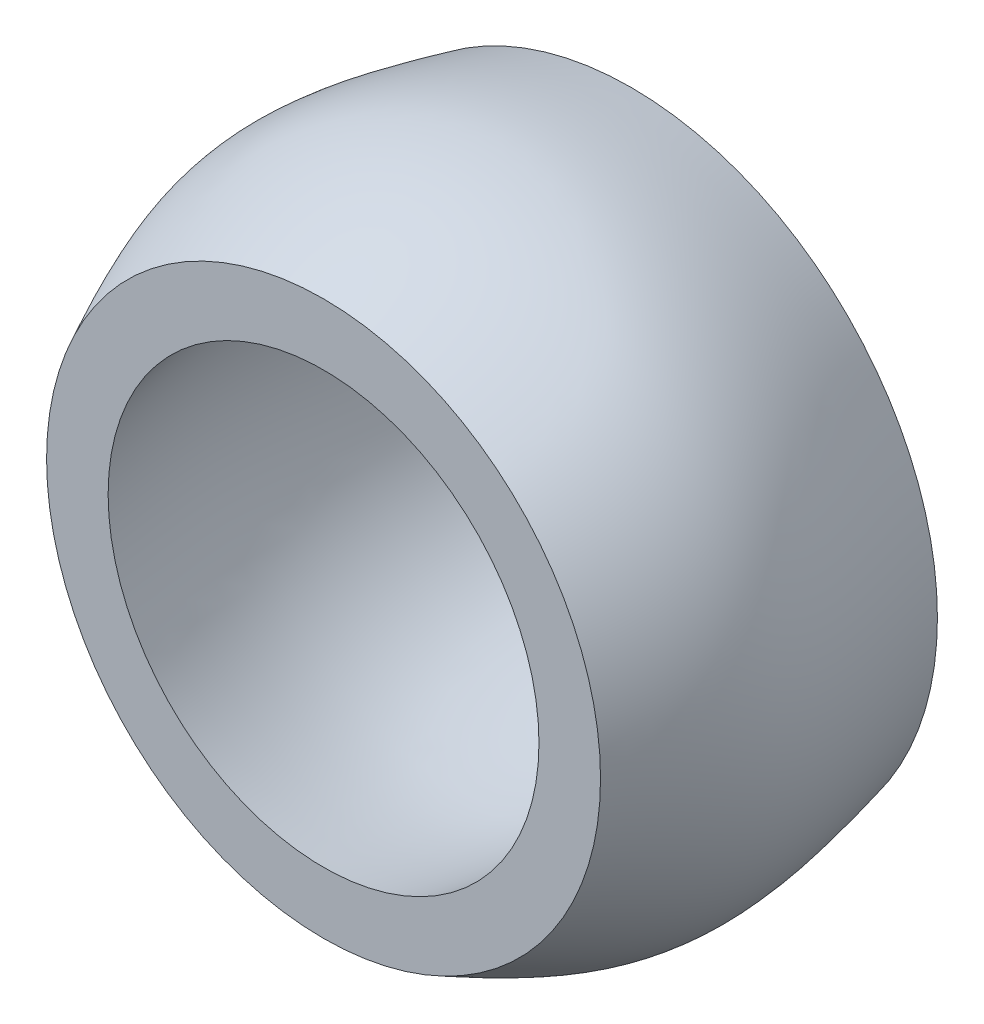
SolidWorks part; units mm, degrees
ref_plane "Face" through (0, 0, 0) normal (0, 0, 1) x (1, 0, 0)
ref_plane "Dessus" through (0, 0, 0) normal (0, 1, 0) x (1, 0, 0)
ref_plane "Droite" through (0, 0, 0) normal (1, 0, 0) x (0, 0, -1)
sketch "Esquisse2" plane through (0, 0, 0) normal (0, 1, 0) x (1, 0, 0)
  line L1 (14, -20) -> (-14, -20) construction
  line L2 (0, 0) -> (0, -23.8736) construction
  line L3 (14, 0) -> (19.8934, 0)
  line L4 (-20, 0) -> (20, 0) construction
  line L5 (14, -20) -> (18, -20)
  point P1 (14.9604, -11.7494)
  point P11 (21.1479, -11.7494)
revolve "Révolution1" add sketch "Esquisse2" angle 360 about L2
